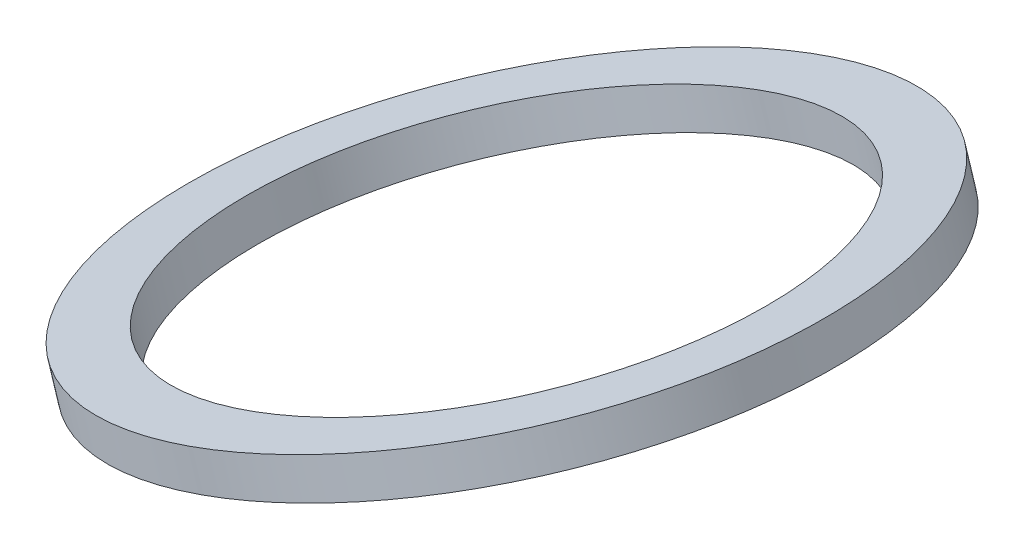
SolidWorks part; units mm, degrees
ref_plane "Alzado" through (0, 0, 0) normal (0, 0, 1) x (1, 0, 0)
ref_plane "Planta" through (0, 0, 0) normal (0, 1, 0) x (1, 0, 0)
ref_plane "Vista lateral" through (0, 0, 0) normal (1, 0, 0) x (0, 0, -1)
sketch "Sk_Arandela" plane through (0, 0, 0) normal (0, 0, 1) x (1, 0, 0)
  line L0 (372.8188, 556.9505) -> (375.8707, 557.9128)
  line L1 (375.8707, 557.9128) -> (376.4721, 556.0054)
  line L2 (376.4721, 556.0054) -> (373.4203, 555.0431)
  line L3 (373.4203, 555.0431) -> (372.8188, 556.9505)
  line L4 (357.6771, 557.4189) -> (368.2021, 524.0389) construction
revolve "Arandela" add sketch "Sk_Arandela" angle 360 about L4
